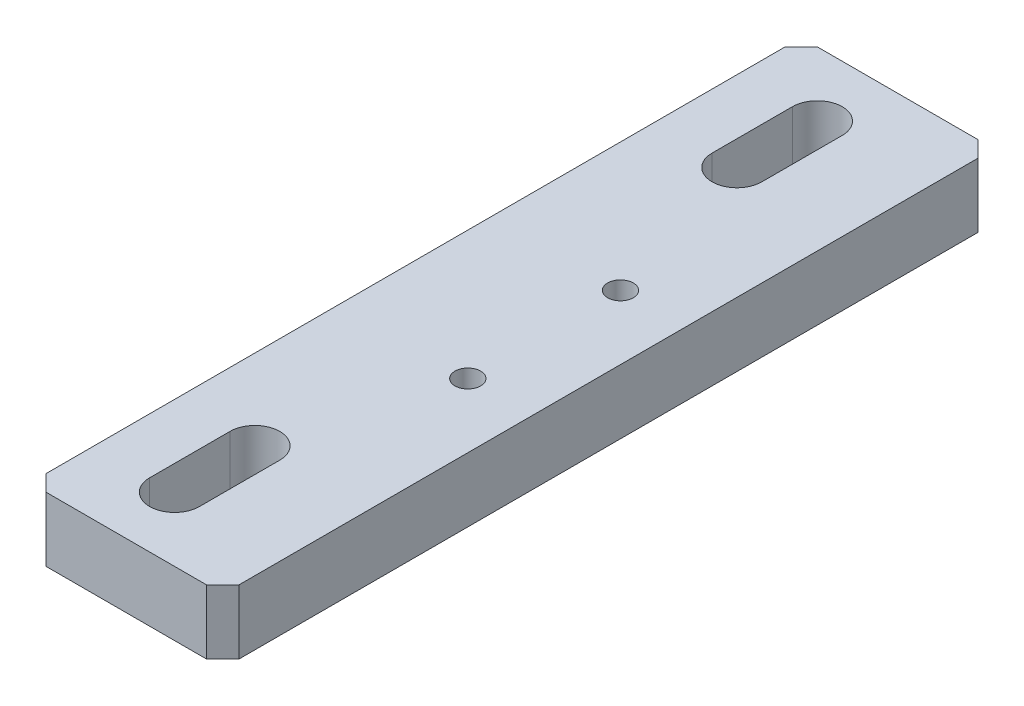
SolidWorks part; units mm, degrees
ref_plane "Plan1" through (0, 0, 0) normal (0, 0, 1) x (1, 0, 0)
ref_plane "Plan2" through (0, 0, 0) normal (0, 1, 0) x (1, 0, 0)
ref_plane "Plan3" through (0, 0, 0) normal (1, 0, 0) x (0, 0, -1)
sketch "Esquisse1" plane through (0, 0, 0) normal (0, 1, 0) x (1, 0, 0)
  line L0 (-4.4849, 0) -> (26.6034, 0) construction
  line L1 (0, 24) -> (12, 24)
  line L2 (0, 24) -> (0, -24)
  line L3 (0, -24) -> (12, -24)
  line L4 (12, 24) -> (12, -24)
  line L5 (-2.75, 0) -> (2.75, 0) construction
  line L6 (5, 20) -> (5, 15) construction
  line L7 (6.55, 20) -> (6.55, 15)
  line L8 (3.45, 20) -> (3.45, 15)
  line L9 (5, -20) -> (5, -15) construction
  line L10 (6.55, -20) -> (6.55, -15)
  line L11 (3.45, -20) -> (3.45, -15)
  arc A0 (6.55, 20) -> (3.45, 20) centre (5, 20) ccw
  arc A1 (3.45, 15) -> (6.55, 15) centre (5, 15) ccw
  arc A2 (6.55, -20) -> (3.45, -20) centre (5, -20) cw
  arc A3 (3.45, -15) -> (6.55, -15) centre (5, -15) cw
  point P11 (5, 17.5)
  point P18 (5, -17.5)
  dimension "D1" = 4
  dimension "D2" = 12
  dimension "D3" = 35
  dimension "D4" = 5
  dimension "D5" = 3.1
  dimension "D6" = 5
  dimension "D7" = 48
extrude "Boss.-Extru.1" add sketch "Esquisse1" along normal blind 4
hole_wizard "Trou taraudé M21" positions "Esquisse2" profile "Esquisse3" tap size "M2" standard "ISO"
sketch "Esquisse2" plane through (0, 4, 0) normal (0, 1, 0) x (1, 0, 0)
  line L2 (-8.6499, 0) -> (17.1488, 0) construction
  line L3 (-2.75, 0) -> (2.75, 0) construction
  line L4 (12, -24) -> (12, 24) construction
  point P0 (8, 4.75)
  point P2 (8, -4.75)
  dimension "D1" = 9.5
  dimension "D2" = 4
sketch "Esquisse3" plane through (8, 4, -4.75) normal (1, 0, 0) x (0, 0, 1)
  line L0 (0, 0) -> (0, 4)
  line L1 (0, 4) -> (0.8, 4)
  line L2 (0.8, 4) -> (0.8, 0)
  line L5 (0.8, 0) -> (0, 0)
  line L11 (0, -6.35) -> (0, 107.95) construction
  dimension "Diamètre du trou pour taraudage jusqu'au prochain" = 1.6
  dimension "Profondeur du trou pour taraudage jusqu'au prochain" = 4
chamfer "Chanfrein1" distance 1 angle 45 4 edges at (12, 2, -24) (12, 2, 24) (0, 2, 24) (0, 2, -24)
